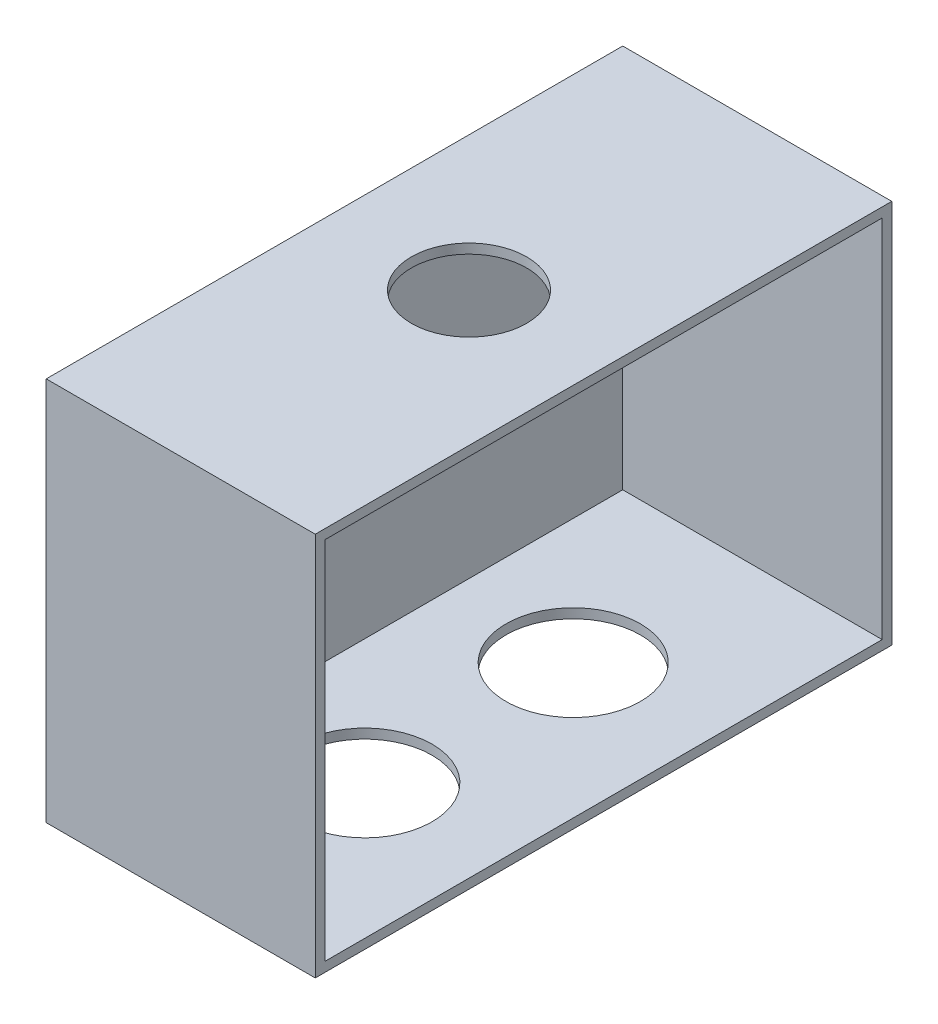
SolidWorks part; units mm, degrees
ref_plane "Front Plane" through (0, 0, 0) normal (0, 0, 1) x (1, 0, 0)
ref_plane "Top Plane" through (0, 0, 0) normal (0, 1, 0) x (1, 0, 0)
ref_plane "Right Plane" through (0, 0, 0) normal (1, 0, 0) x (0, 0, -1)
sketch "Sketch1" plane through (0, 0, 0) normal (1, 0, 0) x (0, 0, -1)
  line L1 (-75, -50) -> (75, -50)
  line L2 (-75, -50) -> (-75, 50)
  line L3 (-75, 50) -> (75, 50)
  line L4 (75, -50) -> (75, 50)
  line L5 (-75, -50) -> (75, 50) construction
  line L6 (-75, 50) -> (75, -50) construction
  point P0 (0, 0)
  dimension "D1" = 100
  dimension "D2" = 150
extrude "Main Unit" add sketch "Sketch1" along normal mid plane 70
sketch "Sketch2" plane through (0, 0, 0) normal (1, 0, 0) x (0, 0, -1)
  line L1 (-72.5, -47.5) -> (72.5, -47.5)
  line L2 (-72.5, -47.5) -> (-72.5, 47.5)
  line L3 (-72.5, 47.5) -> (72.5, 47.5)
  line L4 (72.5, -47.5) -> (72.5, 47.5)
  line L5 (-72.5, -47.5) -> (72.5, 47.5) construction
  line L6 (-72.5, 47.5) -> (72.5, -47.5) construction
  point P0 (0, 0)
  dimension "D1" = 145
  dimension "D2" = 95
extrude "Back Extrude" cut sketch "Sketch2" against normal offset from surface (67.5 mm away) 2.5 from surface at 35
sketch "Sketch3" plane through (0, 0, 0) normal (0, 1, 0) x (1, 0, 0)
  circle A0 centre (0, 0) radius 15
  dimension "D1" = 30
extrude "Cut-Extrude2" cut sketch "Sketch3" against normal up to next (47.5 mm away) from surface at 50
sketch "Sketch4" plane through (0, 0, 0) normal (0, 1, 0) x (1, 0, 0)
  circle A0 centre (0, 27.1082) radius 17.5
  dimension "D1" = 35
extrude "Cut-Extrude4" cut sketch "Sketch4" along normal up to next (47.5 mm away) from surface at -50
mirror "Mirror1" about plane through (0, 0, 0) normal (0, 0, 1) of "Cut-Extrude4"
